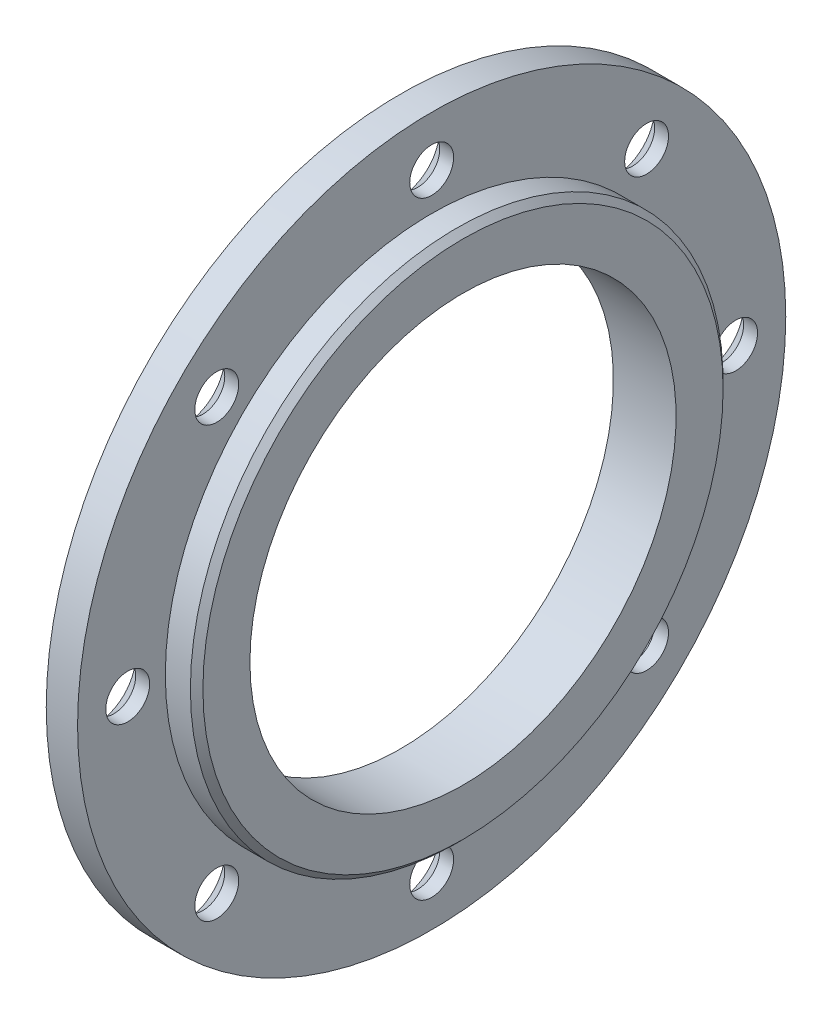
SolidWorks part; units mm, degrees
ref_plane "Plan de face" through (0, 0, 0) normal (0, 0, 1) x (1, 0, 0)
ref_plane "Plan de dessus" through (0, 0, 0) normal (0, 1, 0) x (1, 0, 0)
ref_plane "Plan de droite" through (0, 0, 0) normal (1, 0, 0) x (0, 0, -1)
sketch "Esquisse1" plane through (0, 0, 0) normal (0, 0, 1) x (1, 0, 0)
  line L0 (5, 42.5) -> (5, 56.5)
  line L1 (0, 56.5) -> (5, 56.5)
  line L2 (0, 34) -> (0, 56.5)
  line L3 (9, 42.5) -> (10, 41.5)
  line L4 (10, 41.5) -> (10, 34)
  line L5 (10, 34) -> (0, 34)
  line L6 (-20.4244, 0) -> (67.171, 0) construction
  line L7 (5, 42.5) -> (9, 42.5)
  point P7 (10, 42.5)
  dimension "D1" = 56.5
  dimension "D2" = 34
  dimension "D3" = 1
  dimension "D4" = 45
  dimension "D5" = 5
  dimension "D6" = 5
  dimension "D7" = 42.5
revolve "Révolution1" add sketch "Esquisse1" angle 360 about L6
sketch "Esquisse3" plane through (0, 0, 0) normal (-1, 0, 0) x (0, 0, 1)
  line L0 (0, 61.6516) -> (0, -61.6516) construction
  circle A0 centre (0, 0) radius 48.5 construction
  circle A1 centre (0, 48.5) radius 3.5
  dimension "D1" = 97
  dimension "D2" = 7
extrude "Extrusion2" cut sketch "Esquisse3" against normal blind 9
chamfer "Chanfrein1" distance 2.78 angle 45 1 edges at (0, 48.5, 3.5)
pattern_circular "Répétition circulaire1" count 8 every 45 about axis through (0, 0, 0) along (1, 0, 0) of "Extrusion2", "Chanfrein1"
